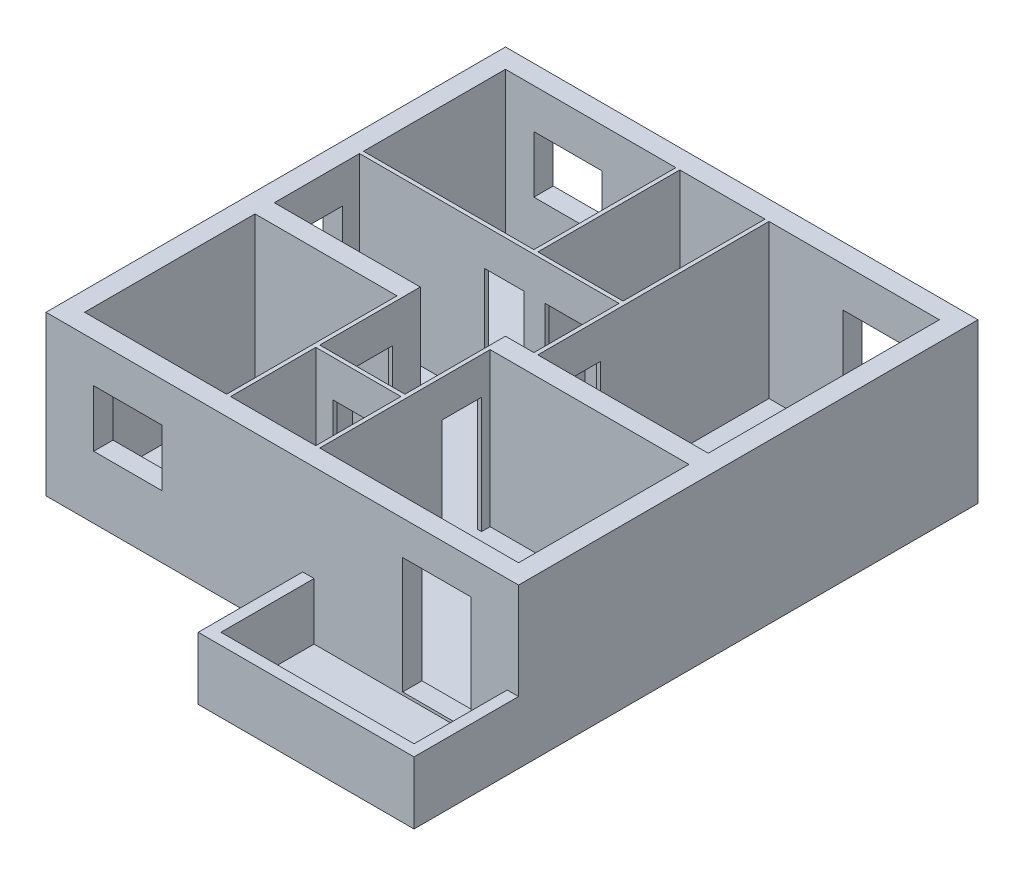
SolidWorks part; units mm, degrees
ref_plane "Plan de face" through (0, 0, 0) normal (0, 0, 1) x (1, 0, 0)
ref_plane "Plan de dessus" through (0, 0, 0) normal (0, 1, 0) x (1, 0, 0)
ref_plane "Plan de droite" through (0, 0, 0) normal (1, 0, 0) x (0, 0, -1)
sketch "Esquisse1" plane through (0, 0, 0) normal (0, -1, 0) x (1, 0, 0)
  line L0 (-2500, -340) -> (-2500, -1840)
  line L1 (0, 0) -> (-2500, 0)
  line L2 (0, 0) -> (0, 3000)
  line L3 (0, 3000) -> (-2500, 3000)
  line L4 (-2500, 0) -> (-2500, 3000)
  line L5 (70, 3000) -> (1570, 3000)
  line L6 (70, 3000) -> (70, 1500)
  line L7 (70, 1500) -> (1570, 1500)
  line L8 (1570, 3000) -> (1570, 1500)
  line L9 (1640, 3000) -> (5140, 3000)
  line L10 (1640, 3000) -> (1640, 0)
  line L11 (1640, 0) -> (5140, 0)
  line L12 (5140, 3000) -> (5140, 0)
  line L13 (2140, -340) -> (5140, -340)
  line L14 (2140, -340) -> (2140, -4410)
  line L15 (2140, -4410) -> (5140, -4410)
  line L16 (5140, -340) -> (5140, -4410)
  line L17 (2070, -4410) -> (570, -4410)
  line L18 (2070, -4410) -> (2070, -1910)
  line L19 (2070, -1910) -> (570, -1910)
  line L20 (570, -4410) -> (570, -1910)
  line L21 (500, -4410) -> (-2500, -4410)
  line L22 (500, -4410) -> (500, -1910)
  line L23 (500, -1910) -> (-2500, -1910)
  line L24 (-2500, -4410) -> (-2500, -1910)
  line L25 (-2840, 3340) -> (5480, 3340)
  line L26 (-2840, 3340) -> (-2840, -4750)
  line L27 (-2840, -4750) -> (5480, -4750)
  line L28 (5480, 3340) -> (5480, -4750)
  line L29 (-2500, -1840) -> (2070, -1840)
  line L30 (2070, -1840) -> (2070, -340)
  line L31 (2070, -340) -> (1570, -340)
  line L32 (1570, -340) -> (1570, 1430)
  line L33 (1570, 1430) -> (70, 1430)
  line L34 (70, 1430) -> (70, -340)
  line L35 (70, -340) -> (-2500, -340)
  dimension "D1" = 2500
  dimension "D2" = 3000
  dimension "D3" = 340
  dimension "D4" = 340
  dimension "D5" = 340
  dimension "D6" = 340
  dimension "D7" = 340
  dimension "D8" = 340
  dimension "D9" = 340
  dimension "D10" = 340
  dimension "D11" = 340
  dimension "D12" = 340
  dimension "D13" = 1500
  dimension "D14" = 1500
  dimension "D15" = 70
  dimension "D16" = 70
  dimension "D17" = 2500
  dimension "D18" = 3000
  dimension "D19" = 2500
  dimension "D20" = 1500
  dimension "D21" = 3000
  dimension "D22" = 3500
  dimension "D23" = 70
  dimension "D24" = 340
  dimension "D25" = 3000
  dimension "D26" = 1500
  dimension "D27" = 340
  dimension "D28" = 70
  dimension "D29" = 340
  dimension "D30" = 70
  dimension "D31" = 70
  dimension "D32" = 70
extrude "Boss.-Extru.1" add sketch "Esquisse1" along normal blind 2700
sketch "Esquisse2" plane through (0, -2700, 0) normal (0, -1, 0) x (1, 0, 0)
  line L1 (5480, -4750) -> (-2840, -4750)
  line L2 (5480, -4750) -> (5480, 3340)
  line L3 (1680, 3340) -> (-2840, 3340)
  line L4 (-2840, -4750) -> (-2840, 3340)
  line L6 (5480, 3340) -> (5480, 5180)
  line L7 (5480, 5180) -> (1680, 5180)
  line L8 (1680, 3340) -> (1680, 5180)
  dimension "D1" = 1840
  dimension "D2" = 3800
extrude "Boss.-Extru.2" add sketch "Esquisse2" along normal blind 100
sketch "Esquisse3" plane through (0, -2700, 0) normal (0, 1, 0) x (1, 0, 0)
  line L0 (5480, -3340) -> (-2840, -3340) construction
  line L1 (5480, -5180) -> (5048.0438, -5180)
  line L2 (5480, -5180) -> (5480, -3340)
  line L3 (5480, -3340) -> (5280, -3340)
  line L4 (5280, -4980) -> (5280, -3340)
  line L5 (5480, -3340) -> (1680, -3340) construction
  line L7 (1680, -5180) -> (1680, -3340)
  line L8 (1680, -3340) -> (1880, -3340)
  line L9 (1880, -4980) -> (1880, -3340)
  line L11 (1680, -5180) -> (5048.0438, -5180)
  line L13 (1880, -4980) -> (5280, -4980)
  dimension "D1" = 200
  dimension "D2" = 200
  dimension "D3" = 200
extrude "Boss.-Extru.3" add sketch "Esquisse3" along normal blind 1000
sketch "Esquisse4" plane through (-2500, 0, 0) normal (1, 0, 0) x (0, 0, -1)
  line L0 (340, -2700) -> (1840, -2700) construction
  line L1 (640, -2700) -> (1540, -2700)
  line L2 (640, -2700) -> (640, -650)
  line L3 (640, -650) -> (1540, -650)
  line L4 (1540, -2700) -> (1540, -650)
  line L5 (1840, -2700) -> (1840, 0) construction
  dimension "D1" = 900
  dimension "D2" = 2050
  dimension "D3" = 300
extrude "Enlèv. mat.-Extru.1" cut sketch "Esquisse4" against normal blind 1000
sketch "Esquisse5" plane through (0, 0, 1430) normal (0, 0, -1) x (-1, 0, 0)
  line L0 (-1570, -2700) -> (-70, -2700) construction
  line L1 (-1070, -2700) -> (-370, -2700)
  line L2 (-1070, -2700) -> (-1070, -650)
  line L3 (-1070, -650) -> (-370, -650)
  line L4 (-370, -2700) -> (-370, -650)
  line L5 (-70, -2700) -> (-70, 0) construction
  dimension "D1" = 700
  dimension "D2" = 2050
  dimension "D3" = 300
extrude "Enlèv. mat.-Extru.2" cut sketch "Esquisse5" against normal blind 1000
sketch "Esquisse6" plane through (1640, 0, 0) normal (1, 0, 0) x (0, 0, -1)
  line L0 (-3000, -2700) -> (0, -2700) construction
  line L1 (-150, -2700) -> (-850, -2700)
  line L2 (-150, -2700) -> (-150, -650)
  line L3 (-150, -650) -> (-850, -650)
  line L4 (-850, -2700) -> (-850, -650)
  line L5 (0, -2700) -> (0, 0) construction
  dimension "D1" = 700
  dimension "D2" = 2050
  dimension "D3" = 150
extrude "Enlèv. mat.-Extru.3" cut sketch "Esquisse6" against normal blind 1921
sketch "Esquisse7" plane through (2070, 0, 0) normal (-1, 0, 0) x (0, 0, 1)
  line L0 (-1840, -2700) -> (-340, -2700) construction
  line L1 (-1440, -2700) -> (-740, -2700)
  line L2 (-1440, -2700) -> (-1440, -650)
  line L3 (-1440, -650) -> (-740, -650)
  line L4 (-740, -2700) -> (-740, -650)
  line L5 (-1840, -2700) -> (-1840, 0) construction
  dimension "D1" = 700
  dimension "D2" = 2050
  dimension "D3" = 400
extrude "Enlèv. mat.-Extru.4" cut sketch "Esquisse7" against normal blind 1921
sketch "Esquisse8" plane through (0, 0, -1910) normal (0, 0, -1) x (-1, 0, 0)
  line L0 (-2070, -2700) -> (-570, -2700) construction
  line L1 (-770, -2700) -> (-1470, -2700)
  line L2 (-770, -2700) -> (-770, -650)
  line L3 (-770, -650) -> (-1470, -650)
  line L4 (-1470, -2700) -> (-1470, -650)
  line L5 (-2070, -2700) -> (-2070, 0) construction
  dimension "D1" = 700
  dimension "D2" = 600
  dimension "D3" = 2050
extrude "Enlèv. mat.-Extru.5" cut sketch "Esquisse8" against normal blind 1412
sketch "Esquisse9" plane through (0, 0, -1910) normal (0, 0, -1) x (-1, 0, 0)
  line L0 (-500, -2700) -> (2500, -2700) construction
  line L1 (-400, -2700) -> (300, -2700)
  line L2 (-400, -2700) -> (-400, -650)
  line L3 (-400, -650) -> (300, -650)
  line L4 (300, -2700) -> (300, -650)
  line L5 (-500, -2700) -> (-500, 0) construction
  dimension "D1" = 2050
  dimension "D2" = 700
  dimension "D3" = 100
extrude "Enlèv. mat.-Extru.6" cut sketch "Esquisse9" against normal blind 1412
sketch "Esquisse10" plane through (0, 0, 3000) normal (0, 0, -1) x (-1, 0, 0)
  line L0 (-5140, -2700) -> (-1640, -2700) construction
  line L1 (-4640, -2650) -> (-3440, -2650)
  line L2 (-4640, -2650) -> (-4640, -600)
  line L3 (-4640, -600) -> (-3440, -600)
  line L4 (-3440, -2650) -> (-3440, -600)
  line L5 (-5140, -2700) -> (-5140, 0) construction
  dimension "D1" = 2050
  dimension "D2" = 1200
  dimension "D3" = 50
  dimension "D4" = 500
extrude "Enlèv. mat.-Extru.7" cut sketch "Esquisse10" against normal blind 668
sketch "Esquisse11" plane through (0, 0, -4410) normal (0, 0, 1) x (1, 0, 0)
  line L0 (2140, -2700) -> (5140, -2700) construction
  line L1 (4640, -700) -> (3440, -700)
  line L2 (4640, -700) -> (4640, -1700)
  line L3 (4640, -1700) -> (3440, -1700)
  line L4 (3440, -700) -> (3440, -1700)
  line L5 (5140, -2700) -> (5140, 0) construction
  dimension "D1" = 1000
  dimension "D2" = 1200
  dimension "D3" = 1000
  dimension "D4" = 500
extrude "Enlèv. mat.-Extru.8" cut sketch "Esquisse11" against normal blind 668
sketch "Esquisse12" plane through (0, 0, 3000) normal (0, 0, -1) x (-1, 0, 0)
  line L0 (0, -2700) -> (2500, -2700) construction
  line L1 (800, -700) -> (2000, -700)
  line L2 (800, -700) -> (800, -1700)
  line L3 (800, -1700) -> (2000, -1700)
  line L4 (2000, -700) -> (2000, -1700)
  line L5 (2500, -2700) -> (2500, 0) construction
  dimension "D1" = 1200
  dimension "D2" = 1000
  dimension "D3" = 1000
  dimension "D4" = 500
extrude "Enlèv. mat.-Extru.9" cut sketch "Esquisse12" against normal blind 668
sketch "Esquisse13" plane through (0, 0, -4410) normal (0, 0, 1) x (1, 0, 0)
  line L0 (-2500, -2700) -> (-2500, 0) construction
  line L1 (-2000, -700) -> (-800, -700)
  line L2 (-2000, -700) -> (-2000, -1700)
  line L3 (-2000, -1700) -> (-800, -1700)
  line L4 (-800, -700) -> (-800, -1700)
  line L5 (-2500, -2700) -> (500, -2700) construction
  dimension "D1" = 1200
  dimension "D2" = 1000
  dimension "D3" = 500
  dimension "D4" = 1000
extrude "Enlèv. mat.-Extru.10" cut sketch "Esquisse13" against normal blind 668
